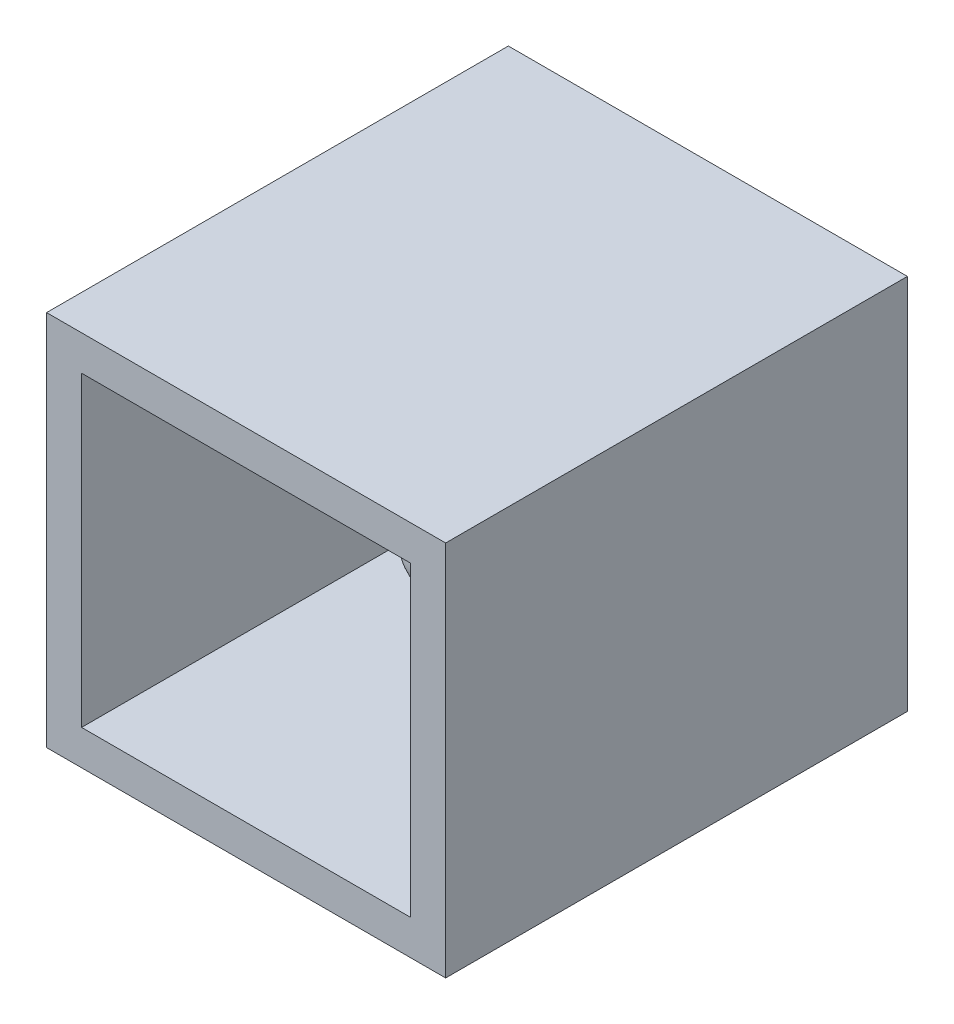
SolidWorks part; units mm, degrees
ref_plane "Front Plane" through (0, 0, 0) normal (0, 0, 1) x (1, 0, 0)
ref_plane "Top Plane" through (0, 0, 0) normal (0, 1, 0) x (1, 0, 0)
ref_plane "Right Plane" through (0, 0, 0) normal (1, 0, 0) x (0, 0, -1)
sketch "Sketch1" plane through (0, 0, 0) normal (0, 0, 1) x (1, 0, 0)
  line L1 (-46.6273, 0) -> (47.451, 0)
  line L2 (-46.6273, 0) -> (-46.6273, 87.6986)
  line L3 (-46.6273, 87.6986) -> (47.451, 87.6986)
  line L4 (47.451, 0) -> (47.451, 87.6986)
extrude "Extrude-Thin1" add sketch "Sketch1" along normal blind 122 thin
sketch "Sketch2" plane through (0, 0, 0) normal (0, 0, -1) x (-1, 0, 0)
  line L4 (56.6273, -10) -> (56.6273, 97.6986)
  line L5 (56.6273, 97.6986) -> (-57.451, 97.6986)
  line L6 (-57.451, 97.6986) -> (-57.451, -10)
  line L7 (-57.451, -10) -> (56.6273, -10)
  line L8 (56.6273, -10) -> (56.6273, 97.6986)
  line L9 (56.6273, 97.6986) -> (-57.451, 97.6986)
  line L10 (-57.451, 97.6986) -> (-57.451, -10)
  line L11 (-57.451, -10) -> (56.6273, -10)
  dimension "D1" = 0
extrude "Boss-Extrude1" add sketch "Sketch2" along normal blind 10
sketch "Sketch3" plane through (0, 0, 0) normal (1, 0, 0) x (0, 0, -1)
  line L0 (-59.6854, 51.4803) -> (-59.6854, 25.556)
  arc A0 (-59.6854, 25.556) -> (-59.6854, 51.4803) centre (-59.6854, 38.5181) ccw
revolve "Revolve1" add sketch "Sketch3" angle 360 about L0
